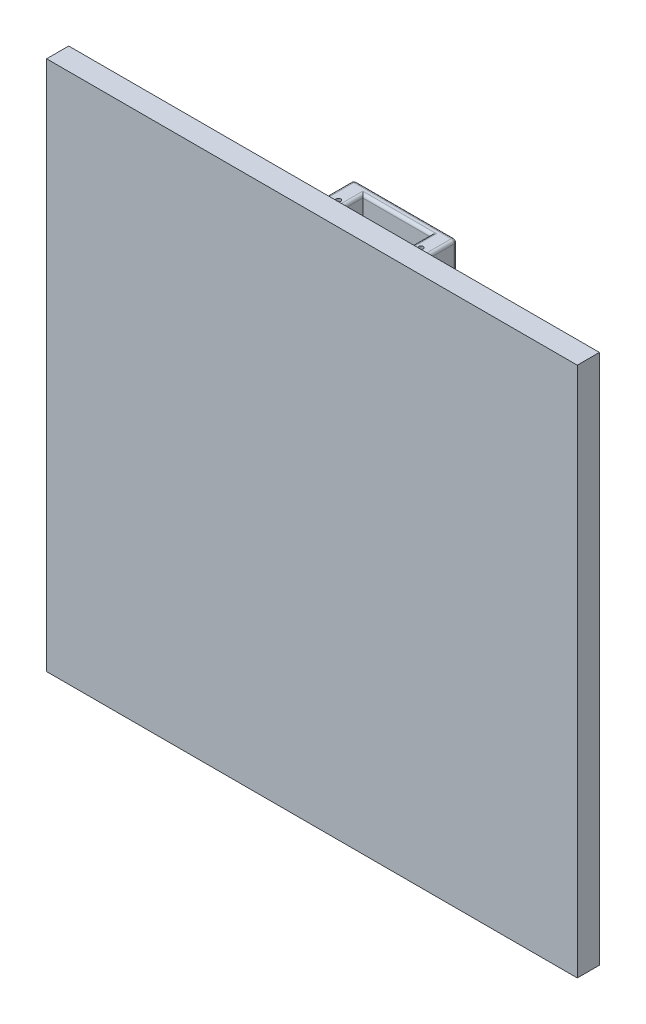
SolidWorks part; units mm, degrees
ref_plane "Ebene vorne" through (0, 0, 0) normal (0, 0, 1) x (1, 0, 0)
ref_plane "Ebene oben" through (0, 0, 0) normal (0, 1, 0) x (1, 0, 0)
ref_plane "Ebene rechts" through (0, 0, 0) normal (1, 0, 0) x (0, 0, -1)
sketch "Skizze1" plane through (0, 0, 0) normal (0, 0, 1) x (1, 0, 0)
  line L1 (0, 0) -> (180, 0)
  line L2 (0, 0) -> (0, 180)
  line L3 (0, 180) -> (180, 180)
  line L4 (180, 0) -> (180, 180)
  dimension "D1" = 180
  dimension "D2" = 180
extrude "Aufsatz-Linear austragen1" add sketch "Skizze1" along normal blind 7.5
sketch "Skizze2" plane through (0, 0, 0) normal (0, 0, -1) x (-1, 0, 0)
  line L0 (-90, 180) -> (-90, 0) construction
  line L1 (-180, 180) -> (0, 180) construction
  line L2 (0, 0) -> (-180, 0) construction
  line L3 (-180, 90) -> (0, 90) construction
  line L4 (-180, 0) -> (-180, 180) construction
  line L5 (0, 180) -> (0, 0) construction
  circle A0 centre (-90, 90) radius 25
  dimension "D1" = 50
extrude "Aufsatz-Linear austragen2" add sketch "Skizze2" along normal blind 50
sketch "Skizze7" plane through (0, 0, -50) normal (0, 0, -1) x (-1, 0, 0)
  line L0 (-115, 90) -> (-65, 90) construction
  circle A0 centre (-90, 90) radius 25 construction
  circle A1 centre (-90, 90) radius 25 construction
  circle A2 centre (-90, 90) radius 20
  dimension "D1" = 40
revolve "Schnitt-Rotation23" cut sketch "Skizze7" angle 180 about L0
fillet "Verrundung1" radius 2.5 1 edges at (65, 90, -50)
fillet "Verrundung2" radius 2.5 1 edges at (70, 90, -50)
sketch "Skizze10" plane through (0, 0, 0) normal (0, 0, -1) x (-1, 0, 0)
  line L0 (-90, 180) -> (-90, 0) construction
  line L1 (-180, 180) -> (0, 180) construction
  line L2 (0, 0) -> (-180, 0) construction
  line L3 (0, 90) -> (-180, 90) construction
  line L4 (0, 180) -> (0, 0) construction
  line L5 (-180, 0) -> (-180, 180) construction
  line L7 (-72.5, 155) -> (-107.5, 155)
  line L8 (-72.5, 155) -> (-72.5, 165)
  line L9 (-72.5, 165) -> (-107.5, 165)
  line L10 (-107.5, 155) -> (-107.5, 165)
  line L11 (-72.5, 155) -> (-107.5, 165) construction
  line L12 (-72.5, 165) -> (-107.5, 155) construction
  point P12 (-90, 160)
  dimension "D1" = 35
  dimension "D2" = 10
  dimension "D3" = 15
extrude "Aufsatz-Linear austragen4" add sketch "Skizze10" along normal blind 24.25
sketch "Skizze12" plane through (0, 165, 0) normal (0, 1, 0) x (1, 0, 0)
  line L0 (90, 24.25) -> (90, 0) construction
  line L1 (72.5, 24.25) -> (107.5, 24.25) construction
  line L2 (180, 0) -> (0, 0) construction
  line L4 (78.5, 8.75) -> (101.5, 8.75)
  line L5 (78.5, 8.75) -> (78.5, 21.25)
  line L6 (78.5, 21.25) -> (101.5, 21.25)
  line L7 (101.5, 8.75) -> (101.5, 21.25)
  line L8 (78.5, 8.75) -> (101.5, 21.25) construction
  line L9 (78.5, 21.25) -> (101.5, 8.75) construction
  point P6 (90, 15)
  dimension "D1" = 23
  dimension "D2" = 12.5
  dimension "D3" = 3
extrude "Schnitt-Linear austragen1" cut sketch "Skizze12" against normal blind 12.5 contours L5 L4 L7 L6
fillet "Verrundung3" radius 1 20 edges at (72.5, 160, 0) (72.5, 160, -24.25) (107.5, 160, -24.25) (107.5, 160, 0) (101.5, 155, -15) (90, 155, -8.75) (78.5, 155, -15) (90, 155, -21.25) (107.5, 155, -12.125) (90, 155, -24.25) (72.5, 155, -12.125) (90, 155, 0) (78.5, 165, -15) (90, 165, -8.75) (101.5, 165, -15) (90, 165, -21.25) (72.5, 165, -12.125) (90, 165, -24.25) (107.5, 165, -12.125) (90, 165, 0)
sketch "Skizze13" plane through (0, 165, 0) normal (0, 1, 0) x (1, 0, 0)
  line L0 (90, 23.25) -> (90, 7.75) construction
  line L1 (106.5, 23.25) -> (73.5, 23.25) construction
  line L2 (102.5, 7.75) -> (77.5, 7.75) construction
  line L3 (76, 15.5) -> (104, 15.5) construction
  circle A0 centre (76, 15.5) radius 0.75
  circle A1 centre (104, 15.5) radius 0.75
  point P9 (90, 15.5)
  dimension "D1" = 14
extrude "Schnitt-Linear austragen2" cut sketch "Skizze13" against normal blind 7.5
sketch "Skizze14" plane through (0, 0, 0) normal (0, 0, -1) x (-1, 0, 0)
  line L0 (0, 90) -> (-180, 90) construction
  line L1 (0, 180) -> (0, 0) construction
  line L2 (-180, 0) -> (-180, 180) construction
  line L4 (-15, 117.5) -> (-25, 117.5)
  line L5 (-15, 117.5) -> (-15, 62.5)
  line L6 (-15, 62.5) -> (-25, 62.5)
  line L7 (-25, 117.5) -> (-25, 62.5)
  line L8 (-15, 117.5) -> (-25, 62.5) construction
  line L9 (-15, 62.5) -> (-25, 117.5) construction
  point P8 (-20, 90)
  dimension "D1" = 55
  dimension "D2" = 10
  dimension "D3" = 15
extrude "Aufsatz-Linear austragen5" add sketch "Skizze14" along normal blind 35
sketch "Skizze15" plane through (15, 0, 0) normal (-1, 0, 0) x (0, 0, 1)
  line L0 (-35, 90) -> (0, 90) construction
  line L1 (-35, 62.5) -> (-35, 117.5) construction
  line L2 (0, 180) -> (0, 0) construction
  line L4 (-30, 69.75) -> (-10.5, 69.75)
  line L5 (-30, 69.75) -> (-30, 110.25)
  line L6 (-30, 110.25) -> (-10.5, 110.25)
  line L7 (-10.5, 69.75) -> (-10.5, 110.25)
  line L8 (-30, 69.75) -> (-10.5, 110.25) construction
  line L9 (-30, 110.25) -> (-10.5, 69.75) construction
  point P6 (-20.25, 90)
  dimension "D1" = 40.5
  dimension "D2" = 19.5
  dimension "D3" = 5
extrude "Schnitt-Linear austragen3" cut sketch "Skizze15" against normal blind 24.25
fillet "Verrundung4" radius 1 20 edges at (20, 62.5, 0) (25, 62.5, -17.5) (25, 90, 0) (25, 90, -30) (25, 110.25, -20.25) (25, 90, -10.5) (25, 69.75, -20.25) (20, 62.5, -35) (25, 90, -35) (20, 117.5, -35) (25, 117.5, -17.5) (20, 117.5, 0) (15, 62.5, -17.5) (15, 90, -35) (15, 117.5, -17.5) (15, 90, 0) (15, 90, -30) (15, 69.75, -20.25) (15, 90, -10.5) (15, 110.25, -20.25)
sketch "Skizze16" plane through (15, 0, 0) normal (-1, 0, 0) x (0, 0, 1)
  line L0 (-15, 116.5) -> (-15, 63.5) construction
  line L1 (-1, 116.5) -> (-34, 116.5) construction
  line L2 (-34, 63.5) -> (-1, 63.5) construction
  line L3 (-31, 90) -> (-9.5, 90) construction
  line L4 (-31, 68.75) -> (-31, 111.25) construction
  line L5 (-9.5, 111.25) -> (-9.5, 68.75) construction
  circle A0 centre (-15, 76) radius 0.75
  circle A1 centre (-15, 104) radius 0.75
  dimension "D1" = 1.5
  dimension "D2" = 14
extrude "Schnitt-Linear austragen4" cut sketch "Skizze16" against normal blind 7.5
